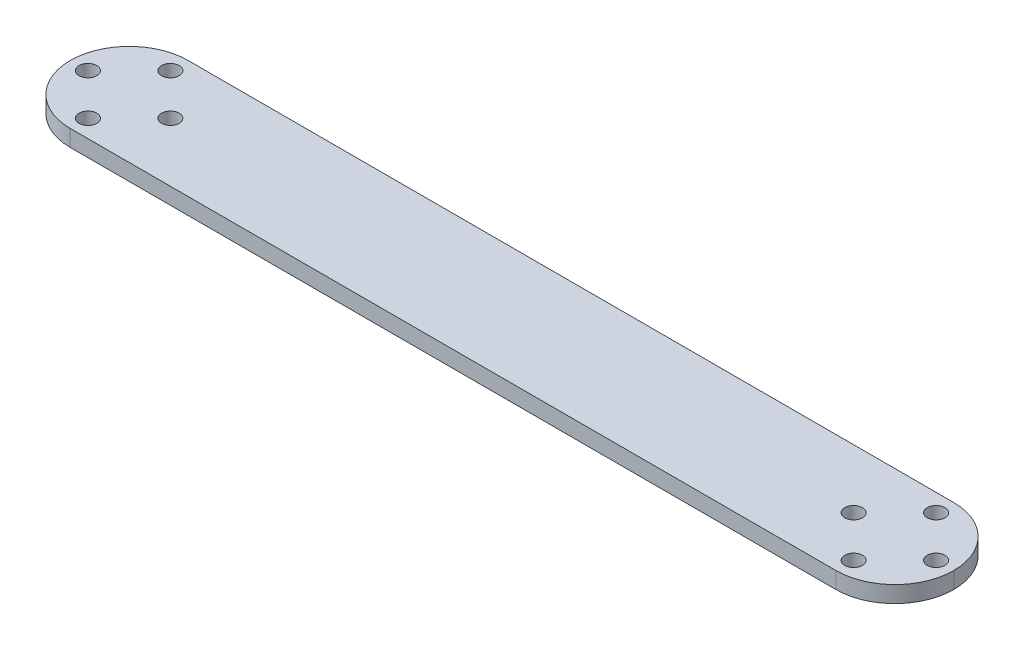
SolidWorks part; units mm, degrees
ref_plane "Front Plane" through (0, 0, 0) normal (0, 0, 1) x (1, 0, 0)
ref_plane "Top Plane" through (0, 0, 0) normal (0, 1, 0) x (1, 0, 0)
ref_plane "Right Plane" through (0, 0, 0) normal (1, 0, 0) x (0, 0, -1)
sketch "Sketch1" plane through (0, 0, 0) normal (0, 1, 0) x (1, 0, 0)
  line L0 (0, 0) -> (0, 20)
  line L1 (0, 20) -> (150, 20)
  line L2 (0, 0) -> (150, 0)
  line L3 (150, 0) -> (150, 20)
extrude "Boss-Extrude1" add sketch "Sketch1" along normal blind 2.8
fillet "Fillet2" radius 10 4 edges at (0, 1.4, 0) (0, 1.4, -20) (150, 1.4, -20) (150, 1.4, 0)
sketch "Sketch4" plane through (0, 0, 0) normal (0, -1, 0) x (-1, 0, 0)
  line L0 (-140, 10) -> (-147, 10) construction
  line L1 (-147, 10) -> (-133, 10) construction
  line L2 (-133, 10) -> (-140, 10) construction
  line L3 (-140, 10) -> (-140, 17) construction
  line L4 (-140, 10) -> (-140, 3) construction
  line L5 (-140, 3) -> (-10, 3) construction
  line L6 (-10, 3) -> (-10, 10) construction
  line L7 (-10, 10) -> (-10, 17) construction
  line L8 (-10, 17) -> (-10, 10) construction
  line L9 (-10, 10) -> (-17, 10) construction
  line L10 (-17, 10) -> (-3, 10) construction
  circle A0 centre (-17, 10) radius 1.5
  circle A1 centre (-10, 3) radius 1.5
  circle A2 centre (-3, 10) radius 1.5
  circle A3 centre (-10, 17) radius 1.5
  circle A4 centre (-140, 3) radius 1.5
  circle A5 centre (-133, 10) radius 1.5
  circle A6 centre (-140, 17) radius 1.5
  circle A7 centre (-147, 10) radius 1.5
extrude "Cut-Extrude2" cut sketch "Sketch4" against normal blind 2.8
